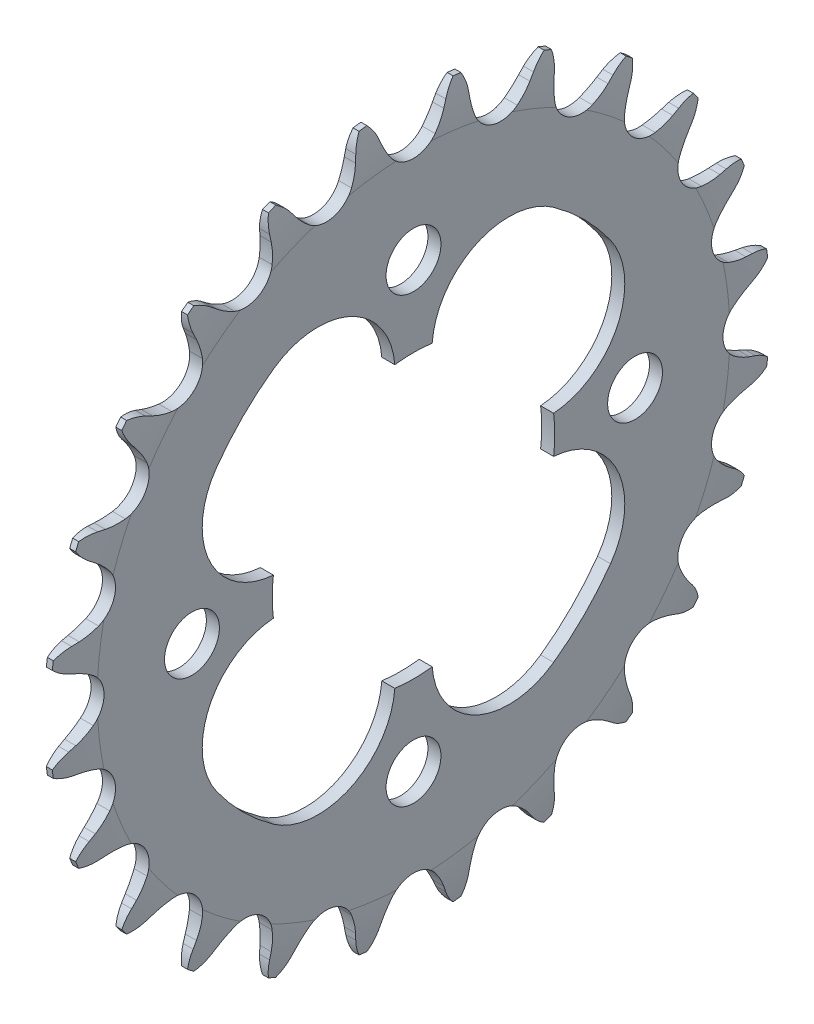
SolidWorks part; units mm, degrees
ref_plane "Plane1" through (0, 0, 0) normal (0, 0, 1) x (1, 0, 0)
ref_plane "Plane2" through (0, 0, 0) normal (0, 1, 0) x (1, 0, 0)
ref_plane "Plane3" through (0, 0, 0) normal (1, 0, 0) x (0, 0, -1)
sketch "Clipboard" plane through (0, 0, 0) normal (0, 1, 0) x (1, 0, 0)
  line L0 (0, 0) -> (11.602, -5.1656)
  line L1 (-15, 0) -> (100, 0) construction
  line L2 (0, 0) -> (-1.0435, 1.1794)
  line L3 (0, 0) -> (-5.9315, 2.2671)
  line L4 (0, 0) -> (5.801, 2.5828)
  line L5 (0, 0) -> (-47.5972, -17.7524)
  line L6 (0, 0) -> (-4.7691, -3.2177)
  line L7 (-1.0435, 1.1794) -> (44.997, 22.6485)
  line L8 (-76.2, 38.1) -> (-47.9044, 38.1)
  line L9 (-73.2057, 38.5609) -> (-73.0533, 38.5634)
  line L10 (-73.0533, 76.1892) -> (-63.5283, 76.1892)
  circle A0 centre (0, 0) radius 3.8862
  circle A1 centre (0, 0) radius 38.1
  circle A2 centre (0, 0) radius 38.1
  dimension "Dr" = 7.7724
  dimension "MHD" = 76.2
  dimension "Hub_dia" = 76.2
  dimension "Num_teeth" = 24
  dimension "Pitch" = 12.7
  dimension "Width" = 6.35
  dimension "Chamfer_wid" = 1.5748
  dimension "Chamfer_dep" = 6.35
  dimension "Overall_len" = 50.8
  dimension "Show_teeth" = 24
  dimension "Thickness" = 5.7531
  dimension "OAL" = 50.8001
  dimension "T_dim" = 28.2956
  dimension "Width_const" = 0.1524
  dimension "Width_factor" = 0.93
  dimension "Num_strands" = 1
  dimension "Transv_pitch" = 9.525
sketch "BasProSke" plane through (0, 0, 0) normal (0, 1, 0) x (1, 0, 0)
  line L0 (-10, 0) -> (60, 0) construction
  line L1 (-0.9398, 0) -> (-0.9398, 45.693)
  line L2 (-0.9398, 0) -> (0.9398, 0)
  line L3 (0.9398, 0) -> (0.9398, 45.693)
  line L4 (0.4318, 52.043) -> (-0.4318, 52.043)
  arc A0 (-0.9398, 45.693) -> (-0.4318, 52.043) centre (39.0017, 45.693) cw
  arc A1 (0.9398, 45.693) -> (0.4318, 52.043) centre (-39.0017, 45.693) ccw
  dimension "D1" = 39.9415
  dimension "G1" = 0.508
  dimension "G2" = 0.508
  dimension "H2" = 6.35
  dimension "Diameter" = 104.0861
  dimension "H1" = 6.35
  dimension "Thickness" = 1.8796
revolve "Base-Revolve" add sketch "BasProSke" angle 360 about L0
sketch "TooCutSke" plane through (0, 0, 0) normal (1, 0, 0) x (0, 0, -1)
  line L0 (4.4997, 48.6553) -> (4.8771, 49.5972)
  line L1 (0, 0) -> (0, 107) construction
  line L2 (0, 48.6492) -> (-10, 48.6492) construction
  line L3 (-4.4997, 48.6553) -> (-4.8771, 49.5972)
  arc A0 (3.1288, 46.2484) -> (4.4997, 48.6553) centre (-4.933, 52.4345) ccw
  arc A1 (3.1288, 46.2484) -> (-3.1288, 46.2484) centre (0, 48.6492) cw
  arc A2 (4.8771, 49.5972) -> (10.7883, 53.5968) centre (10.7883, 47.2289) cw
  arc A3 (-3.1288, 46.2484) -> (-4.4997, 48.6553) centre (4.933, 52.4345) cw
  arc A4 (-4.8771, 49.5972) -> (-10.7883, 53.5968) centre (-10.7883, 47.2289) ccw
  arc A5 (10.7883, 53.5968) -> (-10.7883, 53.5968) centre (0, 0) ccw
  dimension "R" = 3.9437
  dimension "E" = 10.1617
  dimension "F" = 6.3679
  dimension "Pitch_radius" = 48.6492
  dimension "W" = 10.7883
  dimension "V" = 1.4203
  dimension "A" = 37.5
  dimension "B" = 15.667
extrude "ToothCut" cut sketch "TooCutSke" along normal mid plane 5.08
pattern_circular "TeethCuts" count 24 every 15 about axis through (-10, 0, 0) along (1, 0, 0) of "ToothCut"
sketch "BorSke" plane through (0, 0, 0) normal (1, 0, 0) x (0, 0, -1)
  line L0 (0, 0) -> (24.6957, 24.6957) construction
  line L1 (0, 0) -> (0, 32.004) construction
  arc A0 (2.6993, 20.2424) -> (20.2424, 2.6993) centre (0, 0) ccw
  circle A1 centre (0, 32.004) radius 3.9624
  arc A2 (20.2395, 28.4626) -> (28.4626, 20.2395) centre (0, 0) cw
  arc A3 (2.6993, 20.2424) -> (20.2395, 28.4626) centre (13.7923, 19.396) cw
  arc A4 (20.2424, 2.6993) -> (28.4626, 20.2395) centre (19.396, 13.7923) ccw
  dimension "D1" = 32.004
  dimension "Diameter" = 40.8432
  dimension "D2" = 7.9248
  dimension "D5" = 11.1252
  dimension "D3" = 45
  dimension "D4" = 34.925
  dimension "D6" = 7.9248
extrude "Bore" cut sketch "BorSke" along normal mid plane 101.6001
pattern_circular "CirPattern1" count 4 over 360 about axis through (0, 0, 0) along (1, 0, 0) of "Bore"
sketch "Sketch2" plane through (0, 0, 0) normal (1, 0, 0) x (0, 0, -1)
  circle A0 centre (0, 0) radius 48.6492
